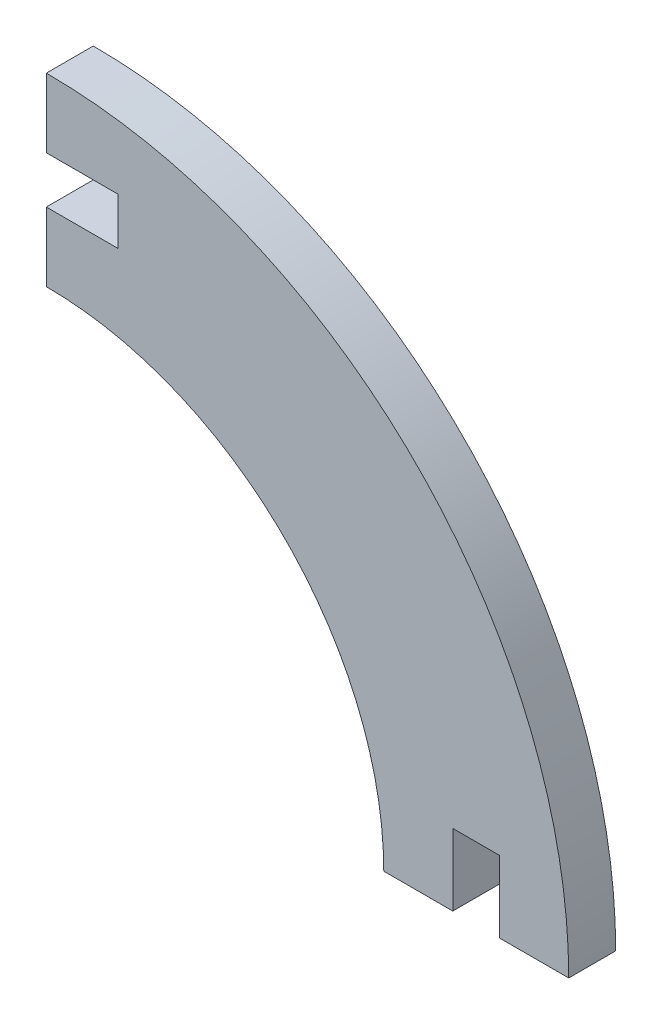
SolidWorks part; units mm, degrees
ref_plane "Front Plane" through (0, 0, 0) normal (0, 0, 1) x (1, 0, 0)
ref_plane "Top Plane" through (0, 0, 0) normal (0, 1, 0) x (1, 0, 0)
ref_plane "Right Plane" through (0, 0, 0) normal (1, 0, 0) x (0, 0, -1)
sketch "Sketch1" plane through (0, 0, 0) normal (0, 0, 1) x (1, 0, 0)
  line L2 (-37.5338, 28.7368) -> (-37.5338, 34.6108)
  line L3 (-37.5338, 34.6108) -> (-31.4378, 34.6108)
  line L4 (-31.4378, 34.6108) -> (-31.4378, 38.6108)
  line L5 (-31.4378, 38.6108) -> (-37.5338, 38.6108)
  line L6 (-37.5338, 38.6108) -> (-37.5338, 44.4848)
  line L7 (-8.797, 0) -> (-2.923, 0)
  line L8 (-2.923, 0) -> (-2.923, 6.096)
  line L9 (-2.923, 6.096) -> (1.077, 6.096)
  line L10 (1.077, 6.096) -> (1.077, 0)
  line L11 (1.077, 0) -> (6.951, 0)
  arc A0 (-8.797, 0) -> (-37.5338, 28.7368) centre (-37.5338, 0) ccw
  arc A1 (-37.5338, 44.4848) -> (6.951, 0) centre (-37.5338, 0) cw
sketch "Sketch3" plane through (0, 0, 0) normal (0, 0, 1) x (1, 0, 0)
extrude "Boss-Extrude1" add sketch "Sketch1" along normal blind 4
equation "\"circle pice\"= 1.6in"
equation "\"exclude cut length\"= 0.24in"
equation "\"exlude cut width\"= 0.24in"
equation "\"exclude gape\"= 0.23126in"
equation "\"D1@Sketch1\"=\"circle pice\""
equation "\"D3@Sketch1\"=\"exlude cut width\""
equation "\"D4@Sketch1\"=\"exlude cut width\""
equation "\"D6@Sketch1\"=\"exclude gape\""
equation "\"D7@Sketch1\"=\"exclude gape\""
equation "\"D9@Sketch1\"=\"exlude cut width\""
equation "\"D8@Sketch1\"=\"exlude cut width\""
equation "\"material\"= 4mm"
equation "\"D2@Sketch1\"=\"exclude gape\""
equation "\"D5@Sketch1\"=\"exclude gape\""
equation "\"D11@Sketch1\"=\"material\""
equation "\"D10@Sketch1\"=\"material\""
